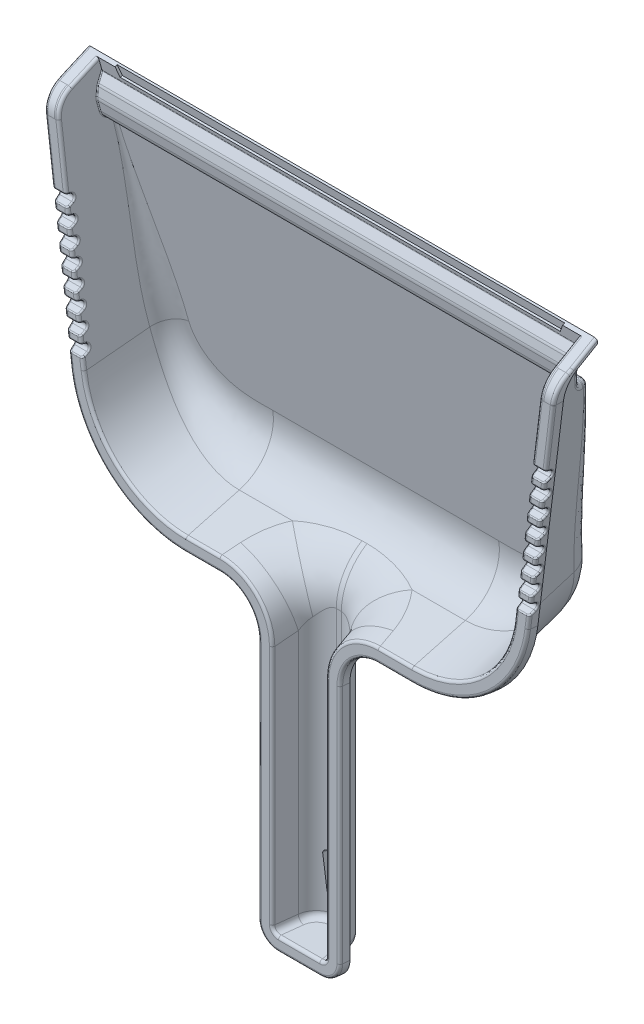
SolidWorks part; units mm, degrees
ref_plane "Front Plane" through (0, 0, 0) normal (0, 0, 1) x (1, 0, 0)
ref_plane "Top Plane" through (0, 0, 0) normal (0, 1, 0) x (1, 0, 0)
ref_plane "Right Plane" through (0, 0, 0) normal (1, 0, 0) x (0, 0, -1)
imported_body "Imported1"
scale "Scale1" scale about centroid uniform scaling yes scale factor 1.04
other "Parting Line1"
other "Shut-Off Surface1"
other "Parting Surface1" parameters "D1"=12.7
